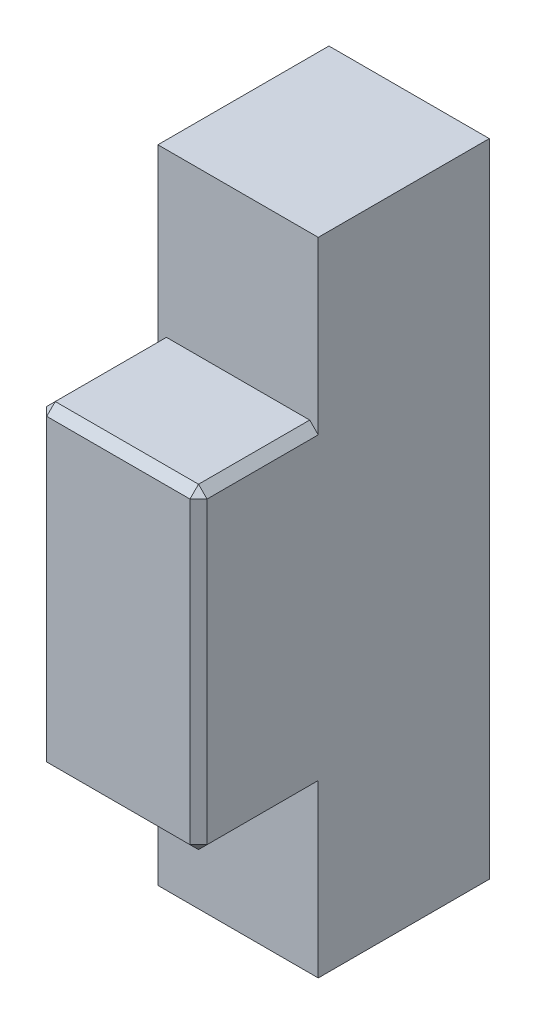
SolidWorks part; units mm, degrees
ref_plane "Plane1" through (0, 0, 0) normal (0, 0, 1) x (1, 0, 0)
ref_plane "Plane2" through (0, 0, 0) normal (0, 1, 0) x (1, 0, 0)
ref_plane "Plane3" through (0, 0, 0) normal (1, 0, 0) x (0, 0, -1)
sketch "Sketch1" plane through (0, 0, 0) normal (0, 0, 1) x (1, 0, 0)
  line L4 (641.2948, 19.05) -> (641.2948, -19.05)
  line L5 (641.2948, -19.05) -> (650.8198, -19.05)
  line L6 (650.8198, -19.05) -> (650.8198, 19.05)
  line L7 (650.8198, 19.05) -> (641.2948, 19.05)
  line L8 (641.2948, 19.05) -> (641.2948, -19.05)
  line L9 (641.2948, -19.05) -> (650.8198, -19.05)
  line L10 (650.8198, -19.05) -> (650.8198, 19.05)
  line L11 (650.8198, 19.05) -> (641.2948, 19.05)
  dimension "D1" = 0
extrude "Base-Extrude" add sketch "Sketch1" along normal blind 10.16
sketch "Sketch2" plane through (0, 0, 10.16) normal (0, 0, 1) x (1, 0, 0)
  line L0 (650.8198, 9.398) -> (641.2948, 9.398)
  line L1 (641.2948, -9.398) -> (650.8198, -9.398)
  line L4 (650.8198, 19.05) -> (641.2948, 19.05)
  line L5 (641.2948, 19.05) -> (641.2948, -19.05)
  line L6 (641.2948, -19.05) -> (650.8198, -19.05)
  line L7 (650.8198, -19.05) -> (650.8198, 19.05)
  line L9 (641.2948, 9.398) -> (641.2948, -9.398)
  line L11 (650.8198, -9.398) -> (650.8198, 9.398)
  dimension "D2" = 9.398
  dimension "D3" = 9.398
  dimension "D1" = 0
extrude "Boss-Extrude1" add sketch "Sketch2" along normal blind 7.112
chamfer "Chamfer1" distance 0.508 angle 45
